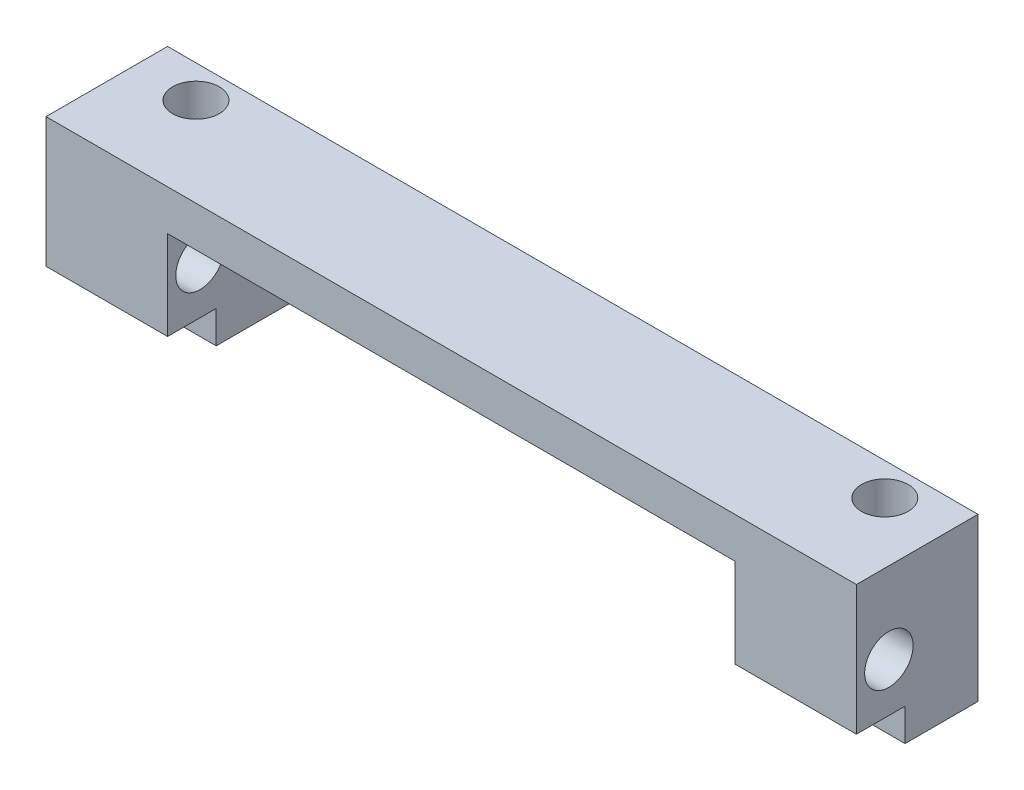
SolidWorks part; units mm, degrees
ref_plane "Front" through (0, 0, 0) normal (0, 0, 1) x (1, 0, 0)
ref_plane "Top" through (0, 0, 0) normal (0, 1, 0) x (1, 0, 0)
ref_plane "Right" through (0, 0, 0) normal (1, 0, 0) x (0, 0, -1)
sketch "Sketch1" plane through (0, 0, 0) normal (0, 1, 0) x (1, 0, 0)
  line L0 (0, 0) -> (0, 9.525) construction
  line L1 (-31.75, 9.525) -> (31.75, 9.525)
  line L2 (-31.75, 9.525) -> (-31.75, 0)
  line L3 (-31.75, 0) -> (31.75, 0)
  line L4 (31.75, 9.525) -> (31.75, 0)
  line L5 (-26.9875, 6.985) -> (26.9875, 6.985) construction
  circle A0 centre (-26.9875, 6.985) radius 1.8288
  circle A1 centre (26.9875, 6.985) radius 1.8288
  dimension "D3" = 53.975
  dimension "D4" = 3.6576
  dimension "D1" = 9.525
  dimension "D2" = 63.5
  dimension "D5" = 2.54
extrude "Extrude1" add sketch "Sketch1" along normal blind 12.7
sketch "Sketch2" plane through (0, 0, 0) normal (0, 0, 1) x (1, 0, 0)
  line L0 (-31.75, 0) -> (31.75, 0) construction
  line L1 (-22.225, 0) -> (22.225, 0)
  line L2 (-22.225, 0) -> (-22.225, 9.525)
  line L3 (-22.225, 9.525) -> (22.225, 9.525)
  line L4 (22.225, 0) -> (22.225, 9.525)
  line L5 (-31.75, 12.7) -> (31.75, 12.7) construction
  line L6 (-31.75, 12.7) -> (-31.75, 0) construction
  line L7 (31.75, 12.7) -> (31.75, 0) construction
  dimension "D1" = 3.175
  dimension "D2" = 9.525
  dimension "D3" = 9.525
extrude "Cut-Extrude1" cut sketch "Sketch2" against normal blind 9.525
hole_wizard "#6 Clearance Hole1" positions "Sketch4" profile "Sketch3" hole size "#6" standard "Ansi Inch"
sketch "Sketch4" plane through (-31.75, 0, 0) normal (-1, 0, 0) x (0, 0, 1)
  line L0 (0, 12.7) -> (0, 0) construction
  line L1 (-9.525, 12.7) -> (0, 12.7) construction
  point P0 (-2.54, 6.35)
  dimension "D1" = 2.54
  dimension "D2" = 6.35
sketch "Sketch3" plane through (-31.75, 6.35, -2.54) normal (0, 1, 0) x (0, 0, 1)
  line L0 (0, 0) -> (0, 79.8808)
  line L1 (0, 79.8808) -> (1.8986, 78.74)
  line L2 (1.8986, 78.74) -> (1.8986, 0)
  line L5 (1.8986, 0) -> (0, 0)
  line L10 (0, 79.8808) -> (-1.8987, 78.74) construction
  line L11 (0, -6.35) -> (0, 107.95) construction
  dimension "Hole Dia." = 3.7973
  dimension "Hole Depth" = 78.74
  dimension "Drill Angle" = 118
sketch "Sketch5" plane through (-31.75, 0, 0) normal (-1, 0, 0) x (0, 0, 1)
  line L1 (0, 0) -> (-3.81, 0)
  line L2 (0, 0) -> (0, 2.54)
  line L3 (0, 2.54) -> (-3.81, 2.54)
  line L4 (-3.81, 0) -> (-3.81, 2.54)
  dimension "D1" = 2.54
  dimension "D2" = 3.81
extrude "Cut-Extrude2" cut sketch "Sketch5" against normal through all
